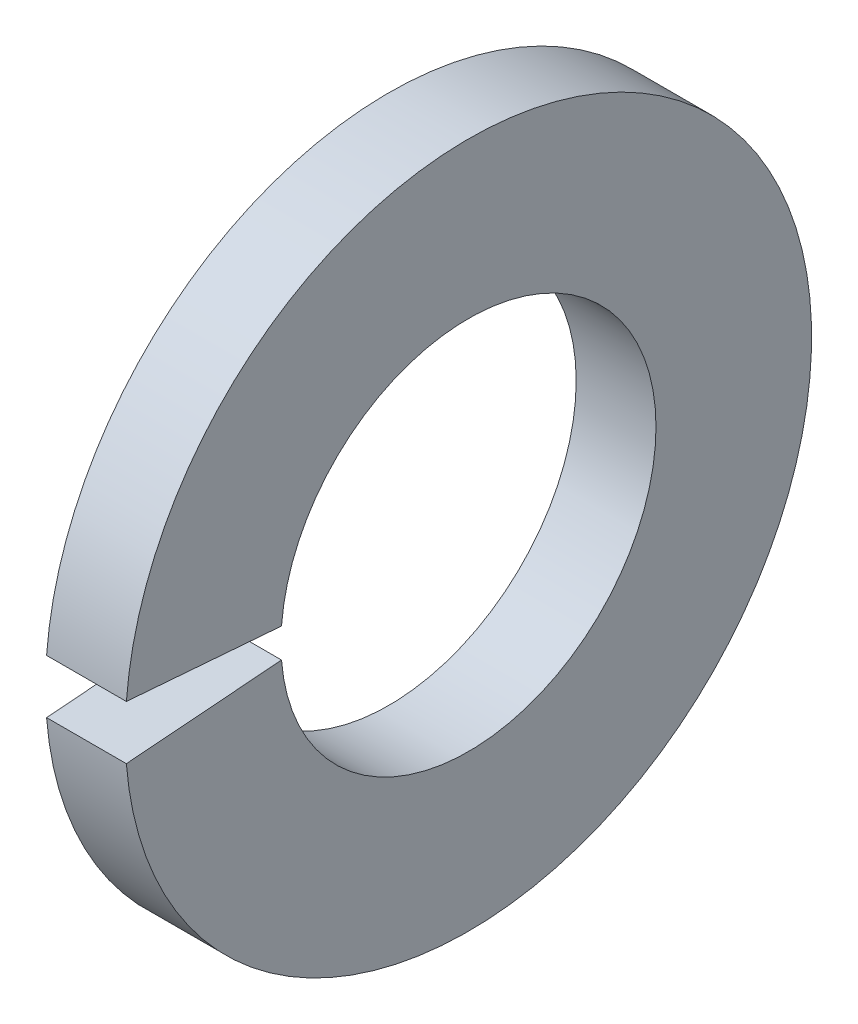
SolidWorks part; units mm, degrees
ref_plane "Plane1" through (0, 0, 0) normal (0, 0, 1) x (1, 0, 0)
ref_plane "Plane2" through (0, 0, 0) normal (0, 1, 0) x (1, 0, 0)
ref_plane "Plane3" through (0, 0, 0) normal (1, 0, 0) x (0, 0, -1)
sketch "Sketch1" plane through (0, 0, 0) normal (0, 0, 1) x (1, 0, 0)
  line L0 (-34.925, 0) -> (9.525, 0) construction
  line L1 (0, 1.1938) -> (0, 2.1844)
  line L2 (0, 2.1844) -> (-0.508, 2.1844)
  line L3 (-0.508, 2.1844) -> (-0.508, 1.1938)
  line L4 (-0.508, 1.1938) -> (0, 1.1938)
revolve "Base-Revolve" add sketch "Sketch1" angle 360 about L0
sketch "Sketch2" plane through (0, 0, 0) normal (-1, 0, 0) x (0, -1, 0)
  line L0 (0, 0) -> (0.1748, 2.2212)
  line L1 (0, -3.175) -> (0, 12.7) construction
  line L2 (0, 0) -> (-0.1748, 2.2212)
  arc A0 (0.1748, 2.2212) -> (-0.1748, 2.2212) centre (0, 0) ccw
extrude "Gap" cut sketch "Sketch2" along normal through all
equation "\"D1@Sketch2\" = \"Outside_dia@Sketch1\" * 0.51"
